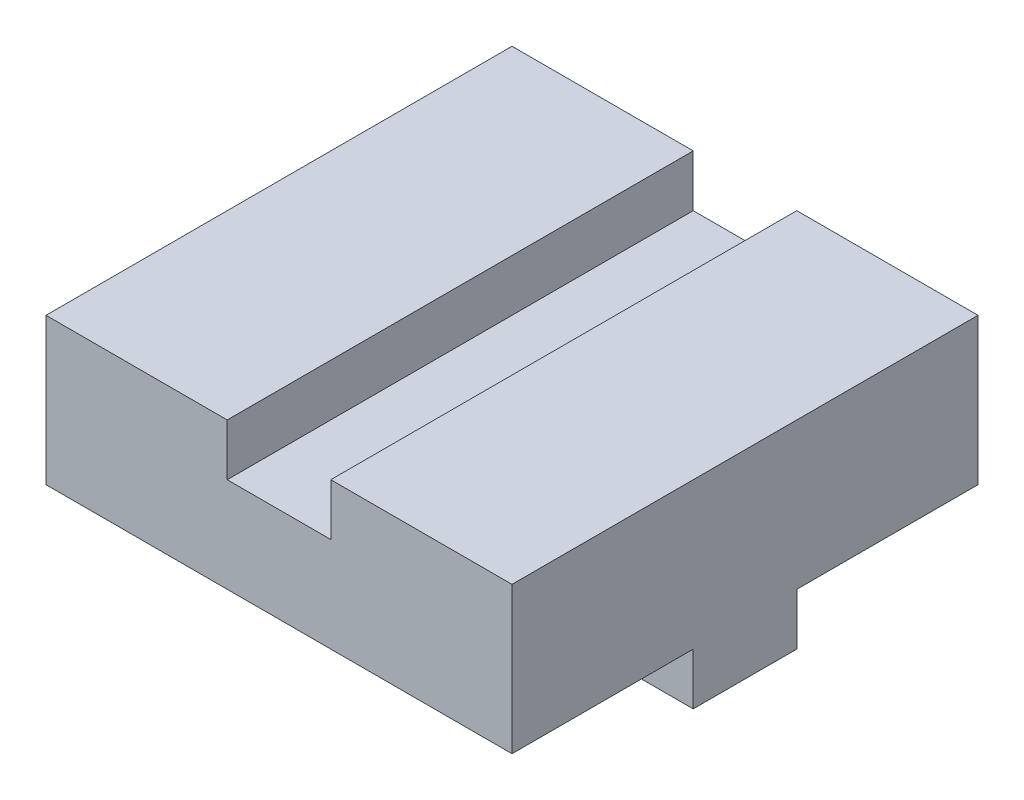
SolidWorks part; units mm, degrees
ref_plane "Front Plane" through (0, 0, 0) normal (0, 0, 1) x (1, 0, 0)
ref_plane "Top Plane" through (0, 0, 0) normal (0, 1, 0) x (1, 0, 0)
ref_plane "Right Plane" through (0, 0, 0) normal (1, 0, 0) x (0, 0, -1)
sketch "Sketch1" plane through (0, 0, 0) normal (0, 1, 0) x (1, 0, 0)
  line L1 (45, -45) -> (-45, -45)
  line L2 (45, -45) -> (45, 45)
  line L3 (45, 45) -> (-45, 45)
  line L4 (-45, -45) -> (-45, 45)
  line L5 (45, -45) -> (-45, 45) construction
  line L6 (45, 45) -> (-45, -45) construction
  point P0 (0, 0)
  dimension "D1" = 90
  dimension "D2" = 90
extrude "Boss-Extrude1" add sketch "Sketch1" along normal blind 28.3333
sketch "Sketch2" plane through (0, 0, 45) normal (0, 0, 1) x (1, 0, 0)
  line L0 (-45, 28.3333) -> (45, 28.3333) construction
  line L1 (-10, 28.3333) -> (10, 28.3333)
  line L2 (-10, 28.3333) -> (-10, 18.3333)
  line L3 (-10, 18.3333) -> (10, 18.3333)
  line L4 (10, 28.3333) -> (10, 18.3333)
  point P6 (0, 18.3333)
  dimension "D1" = 20
  dimension "D2" = 20
  dimension "D3" = 10
extrude "Cut-Extrude1" cut sketch "Sketch2" against normal through all
sketch "Sketch4" plane through (45, 0, 0) normal (1, 0, 0) x (0, 0, -1)
  line L0 (-45, 0) -> (45, 0) construction
  line L1 (-10, 0) -> (10, 0)
  line L2 (-10, 0) -> (-10, -10)
  line L3 (-10, -10) -> (10, -10)
  line L4 (10, 0) -> (10, -10)
  point P6 (0, 0)
  dimension "D1" = 10
  dimension "D2" = 20
extrude "Boss-Extrude3" add sketch "Sketch4" against normal up to surface (90 mm away)
